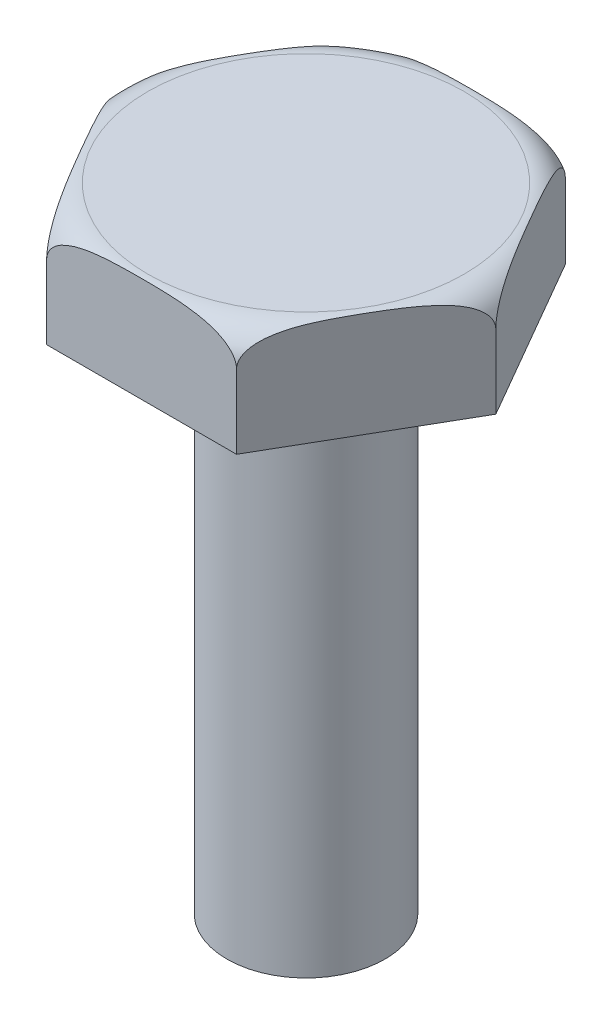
SolidWorks part; units mm, degrees
ref_plane "Front Plane" through (0, 0, 0) normal (0, 0, 1) x (1, 0, 0)
ref_plane "Top Plane" through (0, 0, 0) normal (0, 1, 0) x (1, 0, 0)
ref_plane "Right Plane" through (0, 0, 0) normal (1, 0, 0) x (0, 0, -1)
sketch "Sketch1" plane through (0, 0, 0) normal (0, 1, 0) x (1, 0, 0)
  circle A0 centre (0, 0) radius 7.5
  dimension "D1" = 15
extrude "Extrude1" add sketch "Sketch1" along normal blind 50
sketch "Sketch2" plane through (0, 50, 0) normal (0, 1, 0) x (1, 0, 0)
  line L1 (18, 0) -> (9, 15.5885)
  line L2 (9, 15.5885) -> (-9, 15.5885)
  line L3 (-9, 15.5885) -> (-18, 0)
  line L4 (-18, 0) -> (-9, -15.5885)
  line L5 (-9, -15.5885) -> (9, -15.5885)
  line L6 (9, -15.5885) -> (18, 0)
  circle A0 centre (0, 0) radius 15.5885 construction
  circle A1 centre (0, 0) radius 7.5 construction
  dimension "D2" = 18
extrude "Extrude2" add sketch "Sketch2" along normal blind 10
sketch "Sketch3" plane through (0, 0, 0) normal (0, 0, 1) x (1, 0, 0)
  line L0 (9, 60) -> (18, 60) construction
  line L1 (18, 60) -> (18, 50) construction
  line L2 (0, 0) -> (0, 68.7775) construction
  line L3 (15, 60) -> (18, 60)
  line L4 (18, 60) -> (18, 57)
  arc A0 (15, 60) -> (18, 57) centre (15, 57) cw
  dimension "D1" = 3
revolve "Cut-Revolve1" cut sketch "Sketch3" angle 360 about L2
